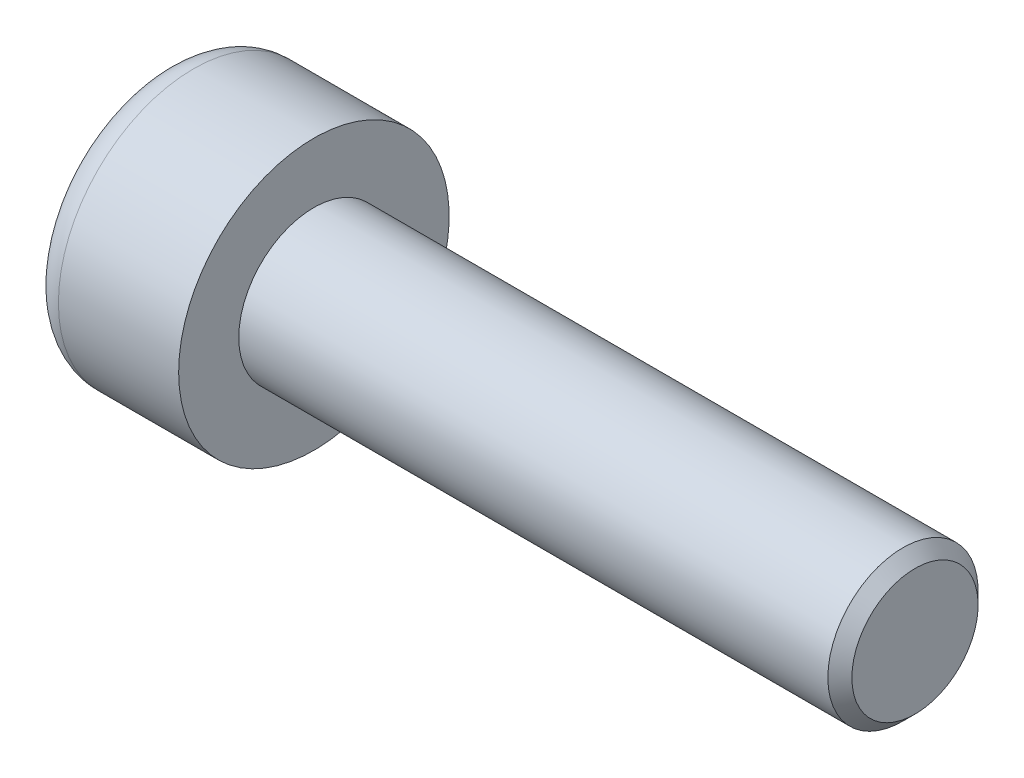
SolidWorks part; units mm, degrees
ref_plane "Face" through (0, 0, 0) normal (0, 0, 1) x (1, 0, 0)
ref_plane "Dessus" through (0, 0, 0) normal (0, 1, 0) x (1, 0, 0)
ref_plane "Droite" through (0, 0, 0) normal (1, 0, 0) x (0, 0, -1)
sketch "Esquisse1" plane through (0, 0, 0) normal (0, 0, 1) x (1, 0, 0)
  line L0 (-28.9827, 0) -> (28.9827, 0) construction
  line L1 (-2.5, 0) -> (-2.5, 2.25)
  line L2 (-2.5, 2.25) -> (0, 2.25)
  line L3 (0, 2.25) -> (0, 1.25)
  line L4 (0, 1.25) -> (10, 1.25)
  line L5 (10, 1.25) -> (10, 0)
  line L6 (10, 0) -> (-2.5, 0)
  dimension "D1" = 1.25
  dimension "D2" = 10
  dimension "D3" = 2.25
  dimension "D4" = 2.5
revolve "Base-Révolution" add sketch "Esquisse1" angle 360 about L0
chamfer "Chanfrein1" distance 0.2 angle 45 1 edges at (10, 0, 1.25)
fillet "Congé1" radius 0.5 1 edges at (-2.5, 0, 2.25)
sketch "Esquisse2" plane through (-2.5, 0, 0) normal (-1, 0, 0) x (0, 0, 1)
  line L0 (0.5774, -1) -> (-0.5774, -1)
  line L1 (-0.5774, -1) -> (-1.1547, 0)
  line L2 (-1.1547, 0) -> (-0.5774, 1)
  line L3 (-0.5774, 1) -> (0.5774, 1)
  line L4 (0.5774, 1) -> (1.1547, 0)
  line L5 (1.1547, 0) -> (0.5774, -1)
  circle A0 centre (0, 0) radius 1 construction
  dimension "D1" = 2
  dimension "D2" = 120
  dimension "D3" = 120
  dimension "D4" = 120
  dimension "D5" = 120
extrude "Empreinte pour clé" cut sketch "Esquisse2" against normal blind 2.5
sketch "Esq_WRNL_Compact001" plane through (0, 0, 0) normal (0, 0, 1) x (1, 0, 0)
  line L0 (-3.5, -3.25) -> (-3.5, 3.25)
  line L1 (11, -3.25) -> (11, 3.25)
  line L2 (-3.5, -3.25) -> (11, -3.25)
  line L3 (-3.5, 3.25) -> (11, 3.25)
